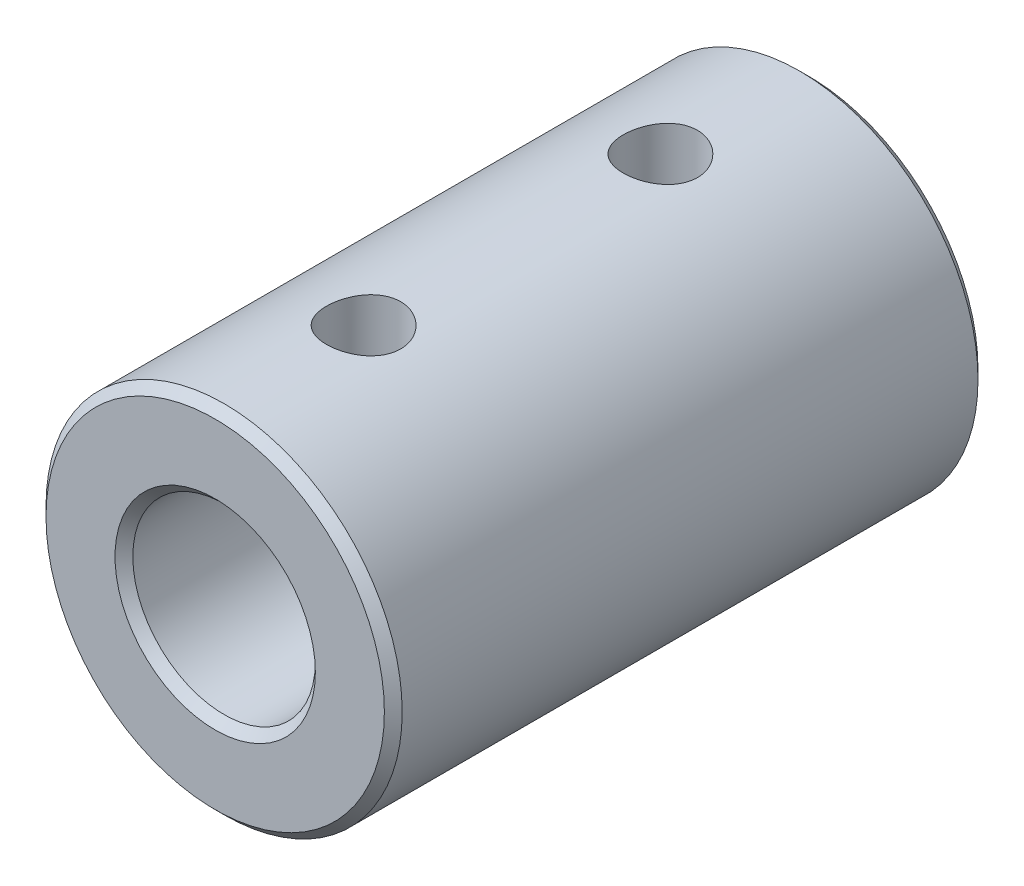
SolidWorks part; units mm, degrees
ref_plane "Plan de face" through (0, 0, 0) normal (0, 0, 1) x (1, 0, 0)
ref_plane "Plan de dessus" through (0, 0, 0) normal (0, 1, 0) x (1, 0, 0)
ref_plane "Plan de droite" through (0, 0, 0) normal (1, 0, 0) x (0, 0, -1)
sketch "Esquisse1" plane through (0, 0, 0) normal (0, 0, 1) x (1, 0, 0)
  circle A0 centre (0, 0) radius 6
  circle A1 centre (0, 0) radius 2.575
extrude "Boss.-Extru.1" add sketch "Esquisse1" along normal mid plane 20
sketch "Esquisse2" plane through (0, 0, 10) normal (0, 0, 1) x (1, 0, 0)
  circle A0 centre (0, 0) radius 3.075
extrude "Enlèv. mat.-Extru.1" cut sketch "Esquisse2" against normal blind 10
ref_plane "Plan1" through (0, 0, 0) normal (0, 1, 0) x (-1, 0, 0)
sketch "Esquisse3" plane through (0, 0, 0) normal (0, 1, 0) x (-1, 0, 0)
  line L0 (0, -2.4446) -> (0, 9.3829) construction
  line L1 (-5.1223, 0) -> (1.4849, 0) construction
  line L2 (-5.1223, 5) -> (1.4849, 5) construction
  circle A0 centre (0, 5) radius 1.25
  circle A1 centre (0, -5) radius 1.25
  dimension "D1" = 5
extrude "Enlèv. mat.-Extru.2" cut sketch "Esquisse3" against normal mid plane 12
chamfer "Chanfrein1" distance 0.3 angle 45 4 edges at (6, 0, -10) (2.575, 0, -10) (3.075, 0, 10) (6, 0, 10)
